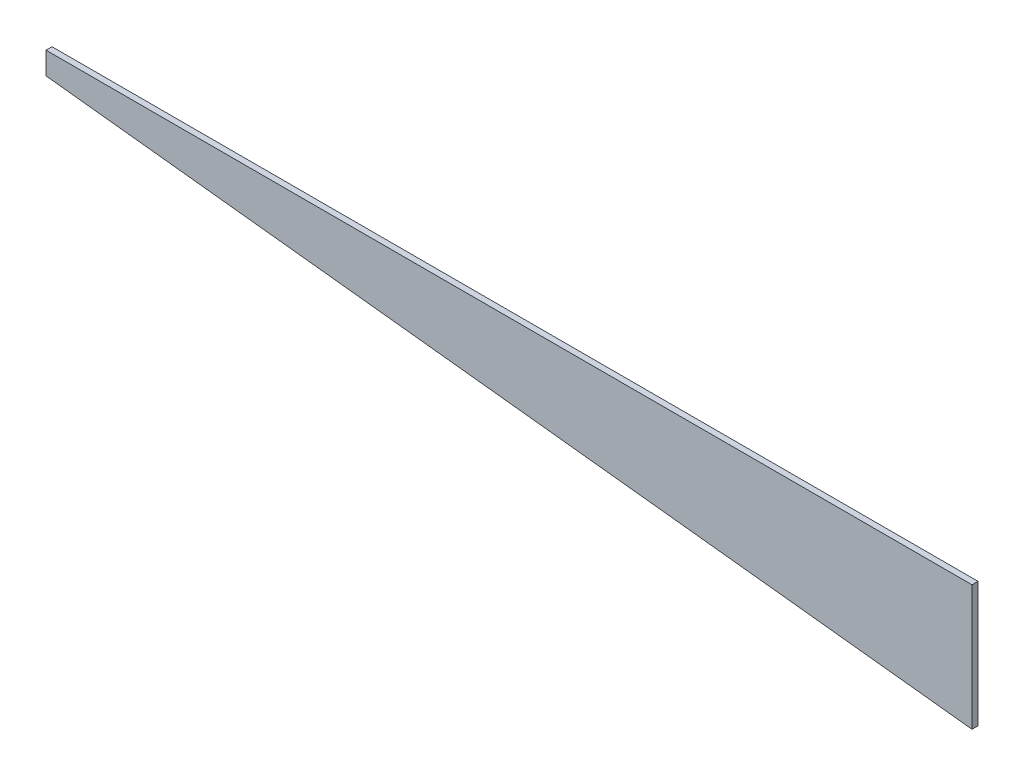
SolidWorks part; units mm, degrees
ref_plane "Front Plane" through (0, 0, 0) normal (0, 0, 1) x (1, 0, 0)
ref_plane "Top Plane" through (0, 0, 0) normal (0, 1, 0) x (1, 0, 0)
ref_plane "Right Plane" through (0, 0, 0) normal (1, 0, 0) x (0, 0, -1)
sketch "Sketch2" plane through (0, 0, 0) normal (0, 0, 1) x (1, 0, 0)
  line L0 (0, 0) -> (-771.525, 0)
  line L1 (-771.525, 0) -> (-771.525, -28.575)
  line L2 (0, 0) -> (0, -114.3)
  line L3 (-771.525, -28.575) -> (0, -114.3)
  line L4 (0, 0) -> (-102.87, -102.87) construction
  line L5 (0, -114.3) -> (-102.87, 0) construction
  line L6 (-102.87, 0) -> (-102.87, -102.87) construction
  line L7 (-205.74, 0) -> (-102.87, -102.87) construction
  line L8 (-205.74, -91.44) -> (-102.87, 0) construction
  line L9 (-205.74, 0) -> (-205.74, -91.44) construction
  line L10 (0, -110.5629) -> (-50.6972, -54.2327)
  line L11 (-205.4328, -87.822) -> (-160.9732, -48.3024)
  line L13 (-205.74, -3.5355) -> (-160.9732, -48.3024)
  line L14 (0, -3.5355) -> (-52.4674, -56.0029)
  line L15 (-3.7371, -113.8848) -> (-54.2376, -57.7731)
  line L16 (-202.3951, -91.8117) -> (-157.4315, -51.844)
  line L17 (-102.87, -99.3345) -> (-57.587, -54.0515)
  line L18 (-205.74, -91.44) -> (-278.892, 0) construction
  line L19 (-202.2045, 0) -> (-157.2297, -44.9748)
  line L20 (-54.0466, -50.5111) -> (-3.5355, 0)
  line L21 (-208.24, 6.0355) -> (-101.1022, -101.1022) construction
  line L22 (-208.24, 6.0355) -> (-208.24, -91.44) construction
  line L23 (-207.4009, -89.5715) -> (-102.6739, 3.5192) construction
  line L24 (-203.24, -6.0355) -> (-203.24, -91.44) construction
  line L25 (-204.0791, -93.3085) -> (-103.0661, -3.5192) construction
  line L26 (1.7678, -1.7678) -> (-102.87, -106.4055) construction
  line L27 (-203.24, -6.0355) -> (-102.87, -106.4055) construction
  line L28 (1.8582, -112.6276) -> (-102.6739, 3.5192) construction
  line L29 (-1.8582, -115.9724) -> (-103.0661, -3.5192) construction
  line L30 (-54.2376, -57.7731) -> (-99.688, -103.2236)
  line L31 (-54.0466, -50.5111) -> (-102.6739, 3.5192)
  line L32 (-57.587, -54.0515) -> (-103.0661, -3.5192)
  line L33 (-157.2297, -44.9748) -> (-102.6739, 3.5192)
  line L34 (-157.4315, -51.844) -> (-106.8475, -102.4281)
  line L35 (-153.688, -48.5165) -> (-102.87, -99.3345)
  line L36 (-153.688, -48.5165) -> (-103.0661, -3.5192)
  line L37 (-278.892, 0) -> (-370.332, -73.152) construction
  line L38 (-370.332, -73.152) -> (-428.8536, 0) construction
  line L39 (-428.8536, 0) -> (-502.0056, -58.5216) construction
  line L40 (-502.0056, -58.5216) -> (-548.8229, 0) construction
  line L41 (-548.8229, 0) -> (-607.3445, -46.8173) construction
  line L42 (-607.3445, -46.8173) -> (-644.7983, 0) construction
  line L43 (-644.7983, 0) -> (-691.6156, -37.4538) construction
  line L44 (-691.6156, -37.4538) -> (-721.5786, 0) construction
  line L45 (-721.5786, 0) -> (-759.0325, -29.9631) construction
  line L46 (-771.525, 0) -> (-759.0325, -29.9631) construction
  line L47 (-205.74, 0) -> (-282.6779, -82.8913) construction
  line L48 (-282.6779, -82.8913) -> (-371.9834, 0) construction
  line L49 (-371.9834, 0) -> (-433.3793, -66.1467) construction
  line L50 (-433.3793, -66.1467) -> (-504.6445, 0) construction
  line L51 (-504.6445, 0) -> (-553.638, -52.7847) construction
  line L52 (-553.638, -52.7847) -> (-610.5071, 0) construction
  line L53 (-610.5071, 0) -> (-649.6037, -42.1218) construction
  line L54 (-649.6037, -42.1218) -> (-694.9849, 0) construction
  line L55 (-694.9849, 0) -> (-726.1836, -33.6129) construction
  line L56 (-726.1836, -33.6129) -> (-786.8395, 0) construction
  line L57 (-786.8395, 0) -> (-771.525, -28.575) construction
  line L58 (-203.7878, -89.8783) -> (-203.869, -89.7769)
  line L59 (-278.5016, 3.5139) -> (-369.9416, -69.6381)
  line L60 (-369.9416, -69.6381) -> (-399.229, -33.0288)
  line L61 (-432.8556, 0) -> (-469.4386, -29.2664)
  line L62 (-501.6152, -55.0077) -> (-525.0735, -25.6847)
  line L63 (-552.8248, 0) -> (-581.8314, -23.2053)
  line L64 (-606.954, -43.3034) -> (-625.6259, -19.9635)
  line L65 (-648.8003, 0) -> (-671.6316, -18.2651)
  line L66 (-691.2251, -33.9399) -> (-705.9695, -15.5095)
  line L67 (-725.5806, 0) -> (-748.5387, -18.3665)
  line L68 (-768.8164, 0) -> (-695.7382, -175.2764)
  line L69 (-771.525, -6.4965) -> (-720.1337, -129.7574)
  line L70 (-721.9691, -3.5139) -> (-743.8102, -20.9868)
  line L71 (-692.006, -40.9677) -> (-709.4085, -19.2146)
  line L72 (-645.1887, -3.5139) -> (-667.9265, -21.7041)
  line L73 (-610.8584, -46.4268) -> (-629.0649, -23.6687)
  line L74 (-549.2133, -3.5139) -> (-578.1263, -26.6443)
  line L75 (-505.5195, -58.1312) -> (-528.5125, -29.3899)
  line L76 (-429.244, -3.5139) -> (-465.7334, -32.7054)
  line L77 (-370.7224, -76.6659) -> (-402.668, -36.7339)
  line L78 (-279.2824, -3.5139) -> (-370.7224, -76.6659)
  line L79 (-209.2539, -91.0496) -> (-245.1694, -46.1553)
  line L80 (-209.1509, 0) -> (-244.8883, -38.5027)
  line L81 (-282.8095, -79.3583) -> (-325.0637, -40.1389)
  line L82 (-375.3943, 0) -> (-433.5109, -62.6137)
  line L83 (-433.5109, -62.6137) -> (-465.7334, -32.7054)
  line L84 (-504.7761, 3.5331) -> (-528.2315, -21.7373)
  line L85 (-553.7696, -49.2516) -> (-578.1263, -26.6443)
  line L86 (-613.9181, 0) -> (-628.7839, -16.0161)
  line L87 (-649.7353, -38.5887) -> (-667.9265, -21.7041)
  line L88 (-698.3958, 0) -> (-709.1274, -11.5621)
  line L89 (-726.6842, -30.4773) -> (-743.8102, -20.9868)
  line L90 (-789.6759, 0) -> (-695.7382, -175.2764)
  line L91 (-402.387, -29.0813) -> (-425.652, 0)
  line L92 (-205.6729, -3.6026) -> (-241.7303, -42.4501)
  line L93 (-286.8525, -82.4275) -> (-329.0111, -43.2968)
  line L94 (-371.8518, -3.5331) -> (-430.2873, -66.4903)
  line L95 (-437.5539, -65.6829) -> (-469.6809, -35.8634)
  line L96 (-504.5129, -3.5331) -> (-550.546, -53.1282)
  line L97 (-557.8126, -52.3208) -> (-582.0737, -29.8022)
  line L98 (-610.3755, -3.5331) -> (-625.6259, -19.9635)
  line L99 (-649.4721, -45.6549) -> (-671.8739, -24.862)
  line L100 (-694.8533, -3.5331) -> (-705.9695, -15.5095)
  line L101 (-732.6349, -32.8961) -> (-748.0316, -24.3639)
  line L102 (-780.6258, -6.3016) -> (-715.6121, -127.6094)
  line L103 (-205.4328, -87.822) -> (-241.7303, -42.4501)
  line L104 (-207.5723, 1.7007) -> (-282.8095, -79.3583) construction
  line L105 (-203.7878, -89.8783) -> (-278.5016, 3.5139) construction
  line L106 (-207.6922, -93.0017) -> (-279.2824, -3.5139) construction
  line L107 (-205.6729, -3.6026) -> (-104.6378, -104.6378) construction
  line L108 (-205.6729, -3.6026) -> (-282.5463, -86.4244) construction
  line L109 (-282.5463, -86.4244) -> (-371.8518, -3.5331) construction
  line L110 (-282.8095, -79.3583) -> (-372.115, 3.5331) construction
  line L111 (-372.115, 3.5331) -> (-433.5109, -62.6137) construction
  line L112 (-405.826, -32.7865) -> (-429.244, -3.5139)
  line L113 (-369.9416, -69.6381) -> (-428.4632, 3.5139) construction
  line L114 (-332.7162, -39.8578) -> (-371.8518, -3.5331)
  line L115 (-370.7224, -76.6659) -> (-429.244, -3.5139) construction
  line L116 (-328.7688, -36.6999) -> (-368.3085, 0)
  line L117 (-245.1694, -46.1553) -> (-279.5859, -83.2349)
  line L118 (-244.8883, -38.5027) -> (-278.5016, 3.5139)
  line L119 (-248.3273, -42.2078) -> (-282.8095, -79.3583)
  line L120 (-248.3273, -42.2078) -> (-279.2824, -3.5139)
  line L121 (-469.4386, -29.2664) -> (-504.7761, 3.5331)
  line L122 (-371.8518, -3.5331) -> (-433.2477, -69.6798) construction
  line L123 (-433.2477, -69.6798) -> (-504.5129, -3.5331) construction
  line L124 (-473.386, -32.4244) -> (-504.5129, -3.5331)
  line L125 (-433.5109, -62.6137) -> (-504.7761, 3.5331) construction
  line L126 (-469.6809, -35.8634) -> (-498.4917, -58.912)
  line L127 (-473.386, -32.4244) -> (-501.6152, -55.0077)
  line L128 (-429.244, -3.5139) -> (-502.396, -62.0355) construction
  line L129 (-528.2315, -21.7373) -> (-545.6213, 0)
  line L130 (-428.4632, 3.5139) -> (-501.6152, -55.0077) construction
  line L131 (-531.6705, -25.4424) -> (-549.2133, -3.5139)
  line L132 (-501.6152, -55.0077) -> (-548.4324, 3.5139) construction
  line L133 (-632.2229, -19.7212) -> (-649.7353, -38.5887)
  line L134 (-502.396, -62.0355) -> (-549.2133, -3.5139) construction
  line L135 (-504.5129, -3.5331) -> (-553.5064, -56.3177) construction
  line L136 (-553.5064, -56.3177) -> (-610.3755, -3.5331) construction
  line L137 (-548.4324, 3.5139) -> (-606.954, -43.3034) construction
  line L138 (-610.6387, 3.5331) -> (-649.7353, -38.5887) construction
  line L139 (-553.7696, -49.2516) -> (-610.6387, 3.5331) construction
  line L140 (-644.4079, 3.5139) -> (-691.2251, -33.9399) construction
  line L141 (-606.954, -43.3034) -> (-644.4079, 3.5139) construction
  line L142 (-629.0649, -23.6687) -> (-649.4721, -45.6549)
  line L143 (-628.7839, -16.0161) -> (-641.5967, 0)
  line L144 (-610.3755, -3.5331) -> (-649.4721, -45.6549) construction
  line L145 (-632.2229, -19.7212) -> (-645.1887, -3.5139)
  line L146 (-582.0737, -29.8022) -> (-603.8306, -47.2077)
  line L147 (-607.7349, -50.3312) -> (-645.1887, -3.5139) construction
  line L148 (-549.2133, -3.5139) -> (-607.7349, -50.3312) construction
  line L149 (-581.8314, -23.2053) -> (-606.8323, 0)
  line L150 (-585.7788, -26.3632) -> (-606.954, -43.3034)
  line L151 (-585.7788, -26.3632) -> (-610.3755, -3.5331)
  line L152 (-531.6705, -25.4424) -> (-553.7696, -49.2516)
  line L153 (-279.2824, -3.5139) -> (-282.8095, -79.3583) construction
  line L154 (-504.7761, 3.5331) -> (-553.7696, -49.2516) construction
  line L155 (-371.8518, -3.5331) -> (-369.9416, -69.6381) construction
  line L156 (-429.244, -3.5139) -> (-433.5109, -62.6137) construction
  line L157 (-504.5129, -3.5331) -> (-501.6152, -55.0077) construction
  line L158 (-549.2133, -3.5139) -> (-553.7696, -49.2516) construction
  line L159 (-605.3126, -8.2324) -> (-606.954, -43.3034) construction
  line L160 (-645.1887, -3.5139) -> (-649.7353, -38.5887) construction
  line L161 (-721.9691, -3.5139) -> (-726.6842, -30.4773) construction
  line L162 (-780.6258, -6.3016) -> (-758.0023, -25.9374) construction
  line L163 (-748.0316, -24.3639) -> (-755.5186, -30.3535)
  line L164 (-721.1882, 3.5139) -> (-758.0023, -25.9374) construction
  line L165 (-691.2251, -33.9399) -> (-721.1882, 3.5139) construction
  line L166 (-695.1165, 3.5331) -> (-726.6842, -30.4773) construction
  line L167 (-649.7353, -38.5887) -> (-695.1165, 3.5331) construction
  line L168 (-726.6842, -30.4773) -> (-793.0532, 6.3016) construction
  line L169 (-793.0532, 6.3016) -> (-773.7285, -29.7559) construction
  line L170 (-773.8325, -0.9621) -> (-760.0626, -33.9887) construction
  line L171 (-769.2175, 0.9621) -> (-758.0023, -25.9374) construction
  line L172 (-780.6258, -6.3016) -> (-769.3215, -27.3941) construction
  line L173 (-721.9691, -3.5139) -> (-760.0626, -33.9887) construction
  line L174 (-725.6831, -36.7485) -> (-780.6258, -6.3016) construction
  line L175 (-694.8533, -3.5331) -> (-725.6831, -36.7485) construction
  line L176 (-752.7601, -21.7436) -> (-758.0023, -25.9374)
  line L177 (-752.7601, -21.7436) -> (-780.6258, -6.3016)
  line L178 (-748.5387, -18.3665) -> (-781.6818, 0)
  line L179 (-740.0076, -82.0904) -> (-768.509, -28.9101)
  line L180 (-715.6121, -127.6094) -> (-758.0023, -25.9374)
  line L181 (-720.1337, -129.7574) -> (-771.525, -33.8674)
  line L182 (-740.0076, -82.0904) -> (-761.8726, -29.6475)
  line L183 (-709.4085, -19.2146) -> (-723.0916, -33.9565)
  line L184 (-712.5665, -15.2672) -> (-726.6842, -30.4773)
  line L185 (-712.5665, -15.2672) -> (-721.9691, -3.5139)
  line L186 (-709.1274, -11.5621) -> (-718.3771, 0)
  line L187 (-692.006, -40.9677) -> (-721.9691, -3.5139) construction
  line L188 (-675.579, -21.423) -> (-691.2251, -33.9399)
  line L189 (-675.579, -21.423) -> (-694.8533, -3.5331)
  line L190 (-671.8739, -24.862) -> (-692.006, -40.9677)
  line L191 (-649.4721, -45.6549) -> (-694.8533, -3.5331) construction
  line L192 (-671.6316, -18.2651) -> (-691.31, 0)
  line L193 (-645.1887, -3.5139) -> (-692.006, -40.9677) construction
  dimension "D1" = 771.525
  dimension "D2" = 28.575
  dimension "D3" = 114.3
  dimension "D4" = 45
  dimension "D5" = 2.5
  dimension "D8" = 45
  dimension "D10" = 90
  dimension "D11" = 90
  dimension "D12" = 90
  dimension "D13" = 45
  dimension "D14" = 90
  dimension "D15" = 90
  dimension "D16" = 90
  dimension "D17" = 90
  dimension "D18" = 90
  dimension "D19" = 90
  dimension "D6" = 2.5
  dimension "D7" = 2.5
  dimension "D9" = 2.5
  dimension "D20" = 2.5
  dimension "D21" = 2.5
  dimension "D22" = 2.5
  dimension "D23" = 2.5
sketch "Sketch3" plane through (0, 0, 0) normal (0, 0, 1) x (1, 0, 0)
  line L0 (-771.525, 0) -> (-771.525, -28.575) construction
  line L1 (0, 0) -> (0, -114.3) construction
  line L2 (-771.525, -28.575) -> (0, -114.3) construction
  line L3 (0, 0) -> (-771.525, 0) construction
  line L4 (-771.525, 0) -> (-771.525, -28.575)
  line L5 (0, 0) -> (0, -114.3)
  line L6 (-771.525, -28.575) -> (0, -114.3)
  line L7 (0, 0) -> (-771.525, 0)
extrude "Boss-Extrude1" add sketch "Sketch3" along normal blind 5
sketch "Sketch6" plane through (0, 0, 5) normal (0, 0, 1) x (1, 0, 0)
  line L0 (0, -114.3) -> (0, 0) construction
  line L2 (0, -10) -> (-771.525, -10)
  line L3 (0, -10) -> (-771.525, -10)
  line L6 (-771.525, -28.575) -> (0, -114.3) construction
  line L7 (-771.525, 0) -> (-771.525, -28.575) construction
  line L8 (0, -114.3) -> (0, 0)
  line L9 (-771.525, -28.575) -> (0, -114.3)
  line L10 (-771.525, 0) -> (-771.525, -28.575)
  line L11 (0, 0) -> (-771.525, 0) construction
  line L12 (0, 0) -> (-771.525, 0)
  dimension "D1" = 10
extrude "Cut-Extrude3" cut sketch "Sketch6" against normal through all contours L3 M5 M2 M3
